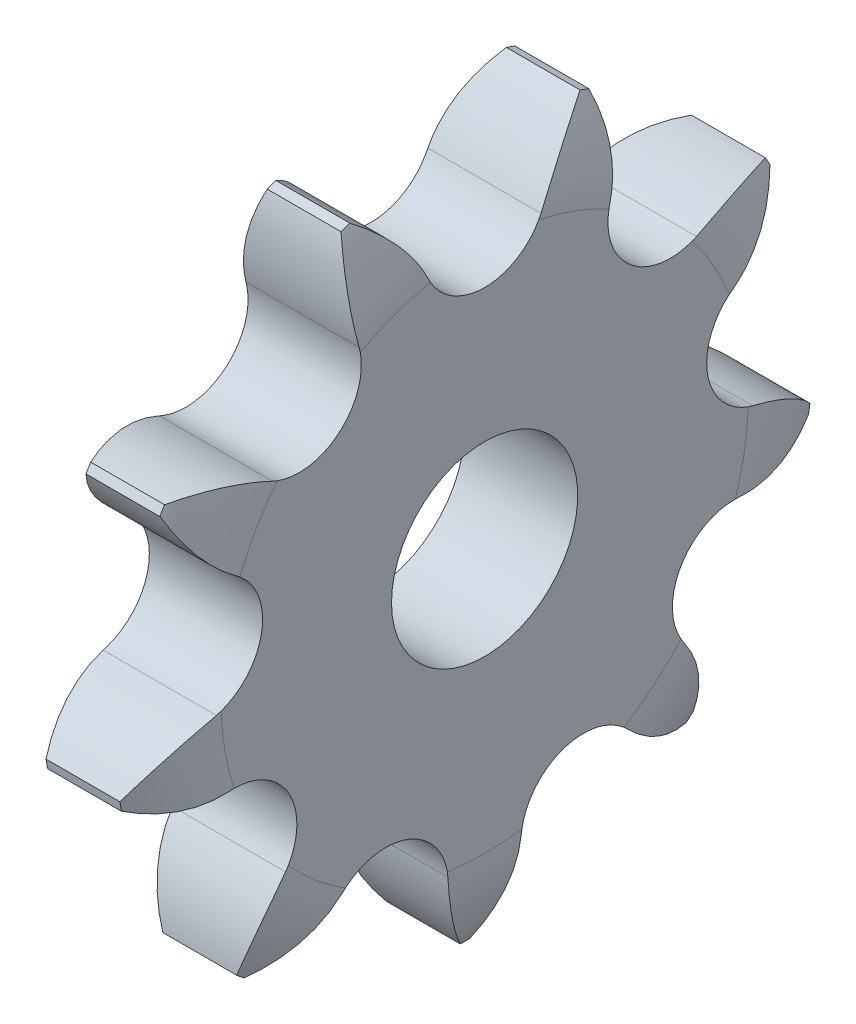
SolidWorks part; units mm, degrees
ref_plane "Plane1" through (0, 0, 0) normal (0, 0, 1) x (1, 0, 0)
ref_plane "Plane2" through (0, 0, 0) normal (0, 1, 0) x (1, 0, 0)
ref_plane "Plane3" through (0, 0, 0) normal (1, 0, 0) x (0, 0, -1)
sketch "Clipboard" plane through (0, 0, 0) normal (0, 1, 0) x (1, 0, 0)
  line L0 (0, 0) -> (12.5436, -1.9867)
  line L1 (-15, 0) -> (100, 0) construction
  line L2 (0, 0) -> (-0.8416, 0.9512)
  line L3 (0, 0) -> (-11.863, 4.5341)
  line L4 (0, 0) -> (3.0618, 0.4849)
  line L5 (0, 0) -> (-2.8109, -1.0484)
  line L6 (0, 0) -> (-6.0514, -4.0829)
  line L7 (-0.8416, 0.9512) -> (8.5146, 2.6009)
  line L8 (-76.2, 38.1) -> (-75.2, 38.1)
  line L9 (-73.4321, 41.7084) -> (-72.837, 41.7846)
  line L10 (-73.4741, 12.9512) -> (-59.0941, 12.9512)
  circle A0 centre (0, 0) radius 3.975
  circle A1 centre (0, 0) radius 10.0465
  circle A2 centre (0, 0) radius 25
sketch "BasProSke" plane through (0, 0, 0) normal (0, 1, 0) x (1, 0, 0)
  line L0 (-10, 0) -> (60, 0) construction
  line L1 (0, 0) -> (0, 16.9929)
  line L2 (0, 0) -> (7.3, 0)
  line L3 (7.3, 0) -> (7.3, 16.9929)
  line L4 (6.03, 22.5287) -> (1.27, 22.5287)
  arc A0 (0, 16.9929) -> (1.27, 22.5287) centre (12.7, 16.9929) cw
  arc A1 (7.3, 16.9929) -> (6.03, 22.5287) centre (-5.4, 16.9929) ccw
revolve "Base-Revolve" add sketch "BasProSke" angle 360 about L0
sketch "TooCutSke" plane through (0, 0, 0) normal (1, 0, 0) x (0, 0, -1)
  line L0 (0, 18.6059) -> (3.6386, 16.9092) construction
  line L1 (0, 0) -> (0, 107) construction
  line L2 (0, 18.6059) -> (-10, 18.6059) construction
  line L3 (0, 18.6059) -> (-3.6386, 16.9092) construction
  arc A0 (3.6386, 16.9092) -> (7.9748, 21.6037) centre (13.1494, 12.4742) cw
  arc A1 (3.6386, 16.9092) -> (-3.6386, 16.9092) centre (0, 18.6059) cw
  arc A2 (-3.6386, 16.9092) -> (-7.9748, 21.6037) centre (-13.1494, 12.4742) ccw
  arc A3 (7.9748, 21.6037) -> (-7.9748, 21.6037) centre (0, 0) ccw
extrude "ToothCut" cut sketch "TooCutSke" along normal through all
pattern_circular "TeethCuts" count 9 every 40 about axis through (-10, 0, 0) along (1, 0, 0) of "ToothCut"
sketch "HubNeaOneSke" plane through (0, 0, 0) normal (-1, 0, 0) x (0, 0, 1)
  circle A0 centre (0, 0) radius 10.0465
extrude "HubNearOne" [suppressed] add sketch "HubNeaOneSke" along normal blind 2.2005
fillet "HubNearOneFillet" [suppressed] radius 0.6
sketch "HubNeaBotSke" plane through (0, 0, 0) normal (-1, 0, 0) x (0, 0, 1)
  circle A0 centre (0, 0) radius 10.0465
extrude "HubNearBoth" [suppressed] add sketch "HubNeaBotSke" along normal blind 1.1003
fillet "HubNearBothFillet" [suppressed] radius 0.6
ref_plane "FarPln" through (7.3, 0, 0) normal (1, 0, 0) x (0, 0, -1)
sketch "HubFarSke" plane through (7.3, 0, 0) normal (1, 0, 0) x (0, 0, -1)
  circle A0 centre (0, 0) radius 10.0465
extrude "HubFar" [suppressed] add sketch "HubFarSke" along normal blind 1.1003
fillet "HubFarFillet" [suppressed] radius 0.6
sketch "BorSke" plane through (0, 0, 0) normal (1, 0, 0) x (0, 0, -1)
  circle A0 centre (0, 0) radius 6
extrude "Bore" cut sketch "BorSke" along normal mid plane 19.001
sketch "KeySke" plane through (0, 0, 0) normal (1, 0, 0) x (0, 0, -1)
  line L0 (-1, 0) -> (-1, 7)
  line L1 (-1, 7) -> (1, 7)
  line L2 (1, 7) -> (1, 0)
  line L3 (0, 0) -> (0, 34) construction
  line L4 (-1, 0) -> (1, 0)
extrude "Keyway" [suppressed] cut sketch "KeySke" along normal mid plane 19.001
pattern_circular "Keyway2" [suppressed] count 2 every 90 about axis through (-10, 0, 0) along (1, 0, 0)
equation "' \"Pitch@Clipboard\" = 12.7"
equation "' \"Num_strands@Clipboard\" = 1"
equation "' \"Num_teeth@Clipboard\" = 9"
equation "' \"Hub_dia@Clipboard\" = 50"
equation "' \"Overall_len@Clipboard\" = 3"
equation "' \"Diameter@BorSke\" = 12"
equation "' \"T_dim@Clipboard\" = 1"
equation "' \"Width@KeySke\" = 2"
equation "' \"Dr@Clipboard\" = 7.95"
equation "' \"Face_width@Clipboard\" = 7.3"
equation "' \"Side_radius@Clipboard\" = 12.7"
equation "' \"Side_relief@Clipboard\" = 1.27"
equation "' \"Transv_pitch@Clipboard\" = 14.38"
equation "' \"Show_teeth@Clipboard\" = 9"
equation "' \"Fillet_rad@Clipboard\" = 0.6"
equation "' \"Plate_wid@Clipboard\" = 12"
equation "\"Num_teeth@Clipboard\" = int( \"Num_teeth@Clipboard\" )"
equation "\"Num_teeth@Clipboard\" = ((sgn( \"Num_teeth@Clipboard\" - 5.0)+1)*( \"Num_teeth@Clipboard\" - 5.0))/2 +5.0"
equation "\"Num_teeth@Clipboard\" = ((sgn( \"Num_teeth@Clipboard\" - 200.0)-1)*( \"Num_teeth@Clipboard\" - 200.0))/-2 +200.0"
equation "\"MHD@Clipboard\" = \"Pitch@Clipboard\" * (1.0 / tan(3.14159265 / \"Num_teeth@Clipboard\" )) - 1.05 * \"Plate_wid@Clipboard\" - 2.0 * \"Fillet_rad@Clipboard\" - 1.0"
equation "\"Thickness@Clipboard\"  = \"Face_width@Clipboard\" + (\"Num_strands@Clipboard\" - 1) * \"Transv_pitch@Clipboard\""
equation "\"OAL@Clipboard\" = \"Thickness@Clipboard\" + 2 * \"Fillet_rad@Clipboard\" + 1"
equation "\"MHD@Clipboard\" = ((sgn( \"MHD@Clipboard\" - \"Hub_dia@Clipboard\" )-1)*( \"MHD@Clipboard\" - \"Hub_dia@Clipboard\" ))/-2+ \"Hub_dia@Clipboard\""
equation "\"OAL@Clipboard\" = ((sgn( \"OAL@Clipboard\" - \"Overall_len@Clipboard\" )+1)*( \"OAL@Clipboard\" - \"Overall_len@Clipboard\" ))/2 + \"Overall_len@Clipboard\" + 0.0005"
equation "\"Num_teeth@TeethCuts\" = int( \"Show_teeth@Clipboard\" ) + 1"
equation "\"Num_teeth@TeethCuts\" = ((sgn( \"Num_teeth@TeethCuts\" - \"Num_teeth@Clipboard\" )-1)*( \"Num_teeth@TeethCuts\" - \"Num_teeth@Clipboard\" ))/-2+ \"Num_teeth@Clipboard\""
equation "\"Num_teeth@TeethCuts\" = ((sgn( \"Num_teeth@TeethCuts\" - 2.0)+1)*( \"Num_teeth@TeethCuts\" - 2.0))/2 +2.0"
equation "\"Angle@TeethCuts\" = 360.0 / \"Num_teeth@Clipboard\""
equation "\"Seat_radius@TooCutSke\" = ( \"Pitch@Clipboard\" / 2.0) / sin(3.14159265 / \"Num_teeth@Clipboard\" ) - \"Dr@Clipboard\" / 2.0 + \"Dr@Clipboard\" * 0.505"
equation "\"R1@TooCutSke\"  = \"Dr@Clipboard\" * 0.505"
equation "\"X@TooCutSke\" = 140.0 - (90.0 / \"Num_teeth@Clipboard\")"
equation "\"R2@TooCutSke\" = 0.12 * \"Dr@Clipboard\" * ( \"Num_teeth@Clipboard\" + 2.0)"
equation "\"Overcut@TooCutSke\" = 0.5 + 0.625 * \"Pitch@Clipboard\" - 0.5 * \"Dr@Clipboard\"  +  \"Pitch@Clipboard\" / 2.0 / sin(3.14159265 / \"Num_teeth@Clipboard\" )"
equation "\"Diameter@BasProSke\" = 2.0 * ( 0.625 * \"Pitch@Clipboard\" - 0.5 * \"Dr@Clipboard\"  +  \"Pitch@Clipboard\" / 2.0 / sin(3.14159265 / \"Num_teeth@Clipboard\" ))"
equation "\"Thickness@BasProSke\"  = \"Thickness@Clipboard\""
equation "\"G1@BasProSke\" =  \"Side_relief@Clipboard\""
equation "\"G2@BasProSke\" =  \"Side_relief@Clipboard\""
equation "\"D1@BasProSke\" =  \"Side_radius@Clipboard\""
equation "\"Diameter@HubNeaOneSke\" = \"MHD@Clipboard\""
equation "\"Length@HubNearOne\" = \"OAL@Clipboard\" - \"Thickness@BasProSke\""
equation "\"Diameter@HubNeaBotSke\" = \"MHD@Clipboard\""
equation "\"Length@HubNearBoth\" = ( \"OAL@Clipboard\" - \"Thickness@BasProSke\" ) / 2.0"
equation "\"D1@HubNearOneFillet\" = \"Fillet_rad@Clipboard\""
equation "\"D1@HubNearBothFillet\" = \"Fillet_rad@Clipboard\""
equation "\"Thickness@FarPln\" = \"Thickness@BasProSke\""
equation "\"Diameter@HubFarSke\" = \"MHD@Clipboard\""
equation "\"Length@HubFar\" = ( \"OAL@Clipboard\" - \"Thickness@BasProSke\" ) / 2.0"
equation "\"D1@HubFarFillet\" = \"Fillet_rad@Clipboard\""
equation "\"D1@Bore\" = \"OAL@Clipboard\" * 2.0"
equation "\"D1@Keyway\" = \"OAL@Clipboard\" * 2.0"
equation "\"Offset@KeySke\" = \"T_dim@Clipboard\" + \"Diameter@BorSke\" / 2.0"
